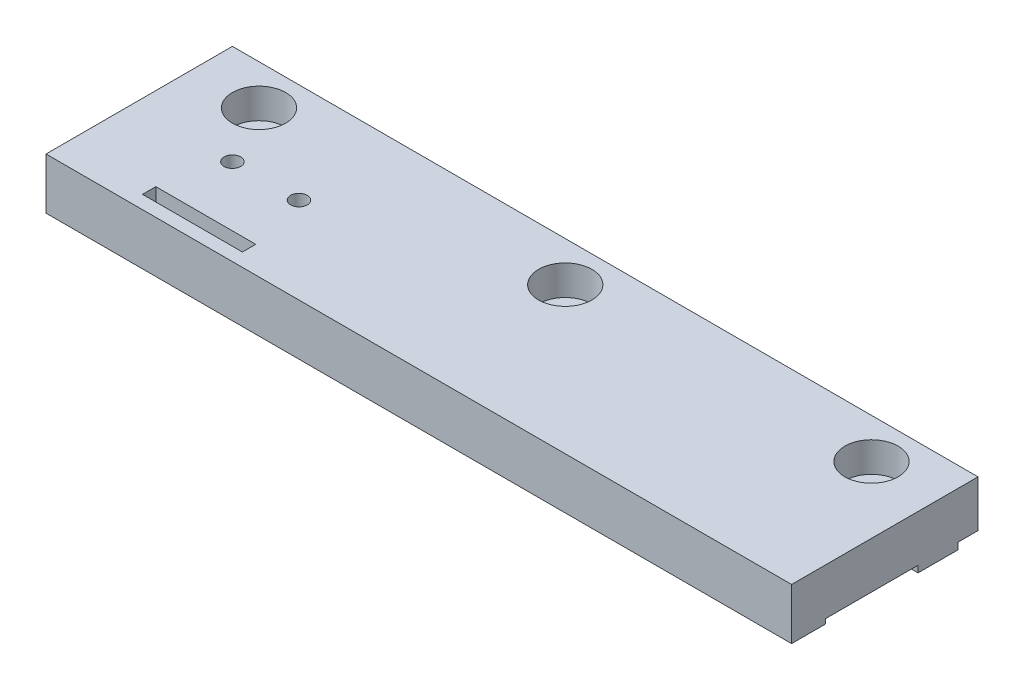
SolidWorks part; units mm, degrees
ref_plane "前视基准面" through (0, 0, 0) normal (0, 0, 1) x (1, 0, 0)
ref_plane "上视基准面" through (0, 0, 0) normal (0, 1, 0) x (1, 0, 0)
ref_plane "右视基准面" through (0, 0, 0) normal (1, 0, 0) x (0, 0, -1)
sketch "草图1" plane through (0, 0, 0) normal (0, 0, 1) x (1, 0, 0)
  line L0 (0, 8) -> (112, 8)
  line L1 (0, 0) -> (112, 0)
  line L2 (112, 0) -> (112, 8)
  line L3 (0, 0) -> (0, 8)
extrude "凸台-拉伸1" add sketch "草图1" along normal blind 28
sketch "草图2" plane through (112, 0, 0) normal (1, 0, 0) x (0, 0, -1)
  line L0 (-9, 0) -> (-9, 1)
  line L1 (-3, 0) -> (-3, 1)
  line L2 (-22.9, 1) -> (-9, 1)
  line L3 (-9, 0) -> (-3, 0)
  line L4 (-28, 8) -> (0, 8)
  line L5 (0, 1) -> (0, 8)
  line L6 (-28, 0.3) -> (-28, 8)
  line L7 (-3, 1) -> (0, 1)
  line L8 (-28, 0.3) -> (-22.9, 0.3)
  line L9 (-22.9, 1) -> (-22.9, 0.3)
extrude "切除-拉伸1" cut sketch "草图2" against normal through all flip side to cut
sketch "草图3" plane through (0, 8, 0) normal (0, 1, 0) x (1, 0, 0)
  line L0 (12.5, -24) -> (27.5, -24)
  line L1 (12.5, -26) -> (27.5, -26)
  line L2 (12.5, -26) -> (12.5, -24)
  line L3 (27.5, -26) -> (27.5, -24)
  circle A0 centre (10, -6) radius 2.25
  circle A1 centre (56, -6) radius 2.25
  circle A2 centre (102, -6) radius 2.25
  circle A3 centre (15, -15) radius 1.25
  circle A4 centre (25, -15) radius 1.25
extrude "切除-拉伸3" cut sketch "草图3" against normal blind 28
sketch "草图4" plane through (0, 8, 0) normal (0, 1, 0) x (1, 0, 0)
  circle A0 centre (10, -6) radius 4
  circle A1 centre (56, -6) radius 4
  circle A2 centre (102, -6) radius 4
extrude "切除-拉伸4" cut sketch "草图4" against normal blind 4.5
